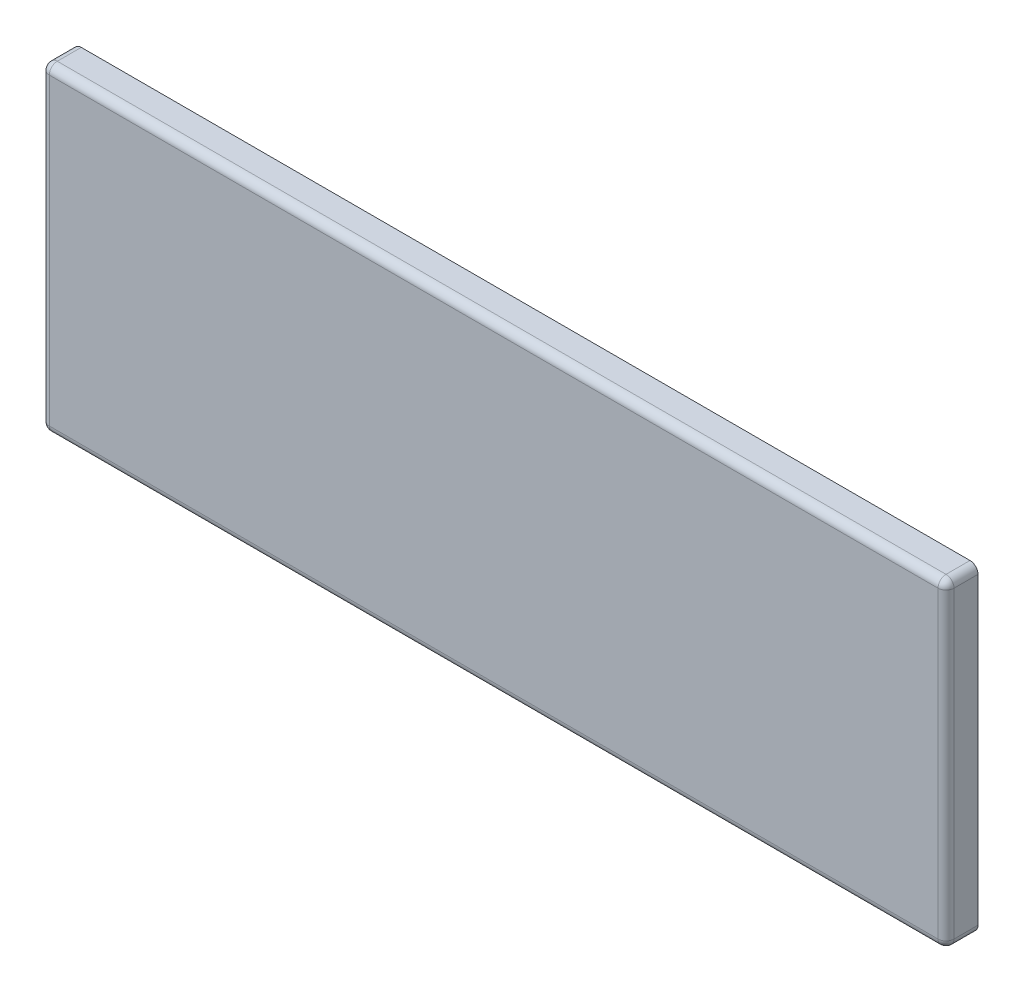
SolidWorks part; units mm, degrees
ref_plane "Alzado" through (0, 0, 0) normal (0, 0, 1) x (1, 0, 0)
ref_plane "Planta" through (0, 0, 0) normal (0, 1, 0) x (1, 0, 0)
ref_plane "Vista lateral" through (0, 0, 0) normal (1, 0, 0) x (0, 0, -1)
sketch "Croquis1" plane through (0, 0, 0) normal (0, 0, 1) x (1, 0, 0)
  line L0 (56.57, 20) -> (-56.57, 20)
  line L1 (-56.57, 20) -> (-56.57, -20)
  line L2 (56.57, -20) -> (-56.57, -20)
  line L3 (56.57, -20) -> (56.57, 20)
extrude "Extruir5" add sketch "Croquis1" along normal blind 4
fillet "Redondeo1" radius 1 8 edges at (0, -20, 4) (56.57, 0, 4) (0, 20, 4) (-56.57, 0, 4) (56.57, -20, 2) (-56.57, -20, 2) (-56.57, 20, 2) (56.57, 20, 2)
